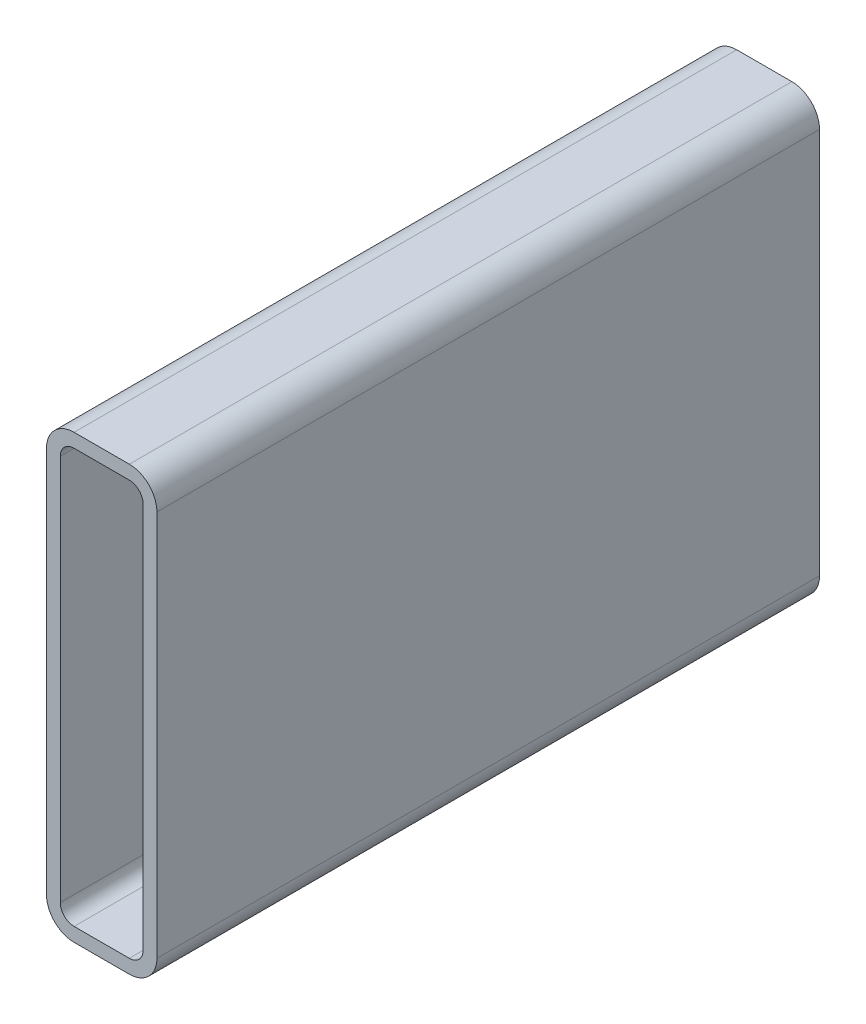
SolidWorks part; units mm, degrees
ref_plane "Front Plane" through (0, 0, 0) normal (0, 0, 1) x (1, 0, 0)
ref_plane "Top Plane" through (0, 0, 0) normal (0, 1, 0) x (1, 0, 0)
ref_plane "Right Plane" through (0, 0, 0) normal (1, 0, 0) x (0, 0, -1)
sketch "Sketch1" plane through (0, 0, 0) normal (0, 0, 1) x (1, 0, 0)
  line B0 (12.7, 203.2) -> (38.1, 203.2)
  arc B1 (50.8, 190.5) -> (38.1, 203.2) centre (38.1, 190.5) ccw
  line B2 (50.8, 190.5) -> (50.8, 12.7)
  arc B3 (38.1, 0) -> (50.8, 12.7) centre (38.1, 12.7) ccw
  line B4 (38.1, 0) -> (12.7, 0)
  arc B5 (0, 12.7) -> (12.7, 0) centre (12.7, 12.7) ccw
  line B6 (0, 12.7) -> (0, 190.5)
  arc B7 (12.7, 203.2) -> (0, 190.5) centre (12.7, 190.5) ccw
  line B8 (12.7, 196.85) -> (38.1, 196.85)
  arc B9 (44.45, 190.5) -> (38.1, 196.85) centre (38.1, 190.5) ccw
  line B10 (44.45, 190.5) -> (44.45, 12.7)
  arc B11 (38.1, 6.35) -> (44.45, 12.7) centre (38.1, 12.7) ccw
  line B12 (38.1, 6.35) -> (12.7, 6.35)
  arc B13 (6.35, 12.7) -> (12.7, 6.35) centre (12.7, 12.7) ccw
  line B14 (6.35, 12.7) -> (6.35, 190.5)
  arc B15 (12.7, 196.85) -> (6.35, 190.5) centre (12.7, 190.5) ccw
sketch_block_instance "HSS8x2x0.250-1"
sketch_block "HSS8x2x0.250"
extrude "Boss-Extrude1" add sketch "Sketch1" along normal blind 304.8
